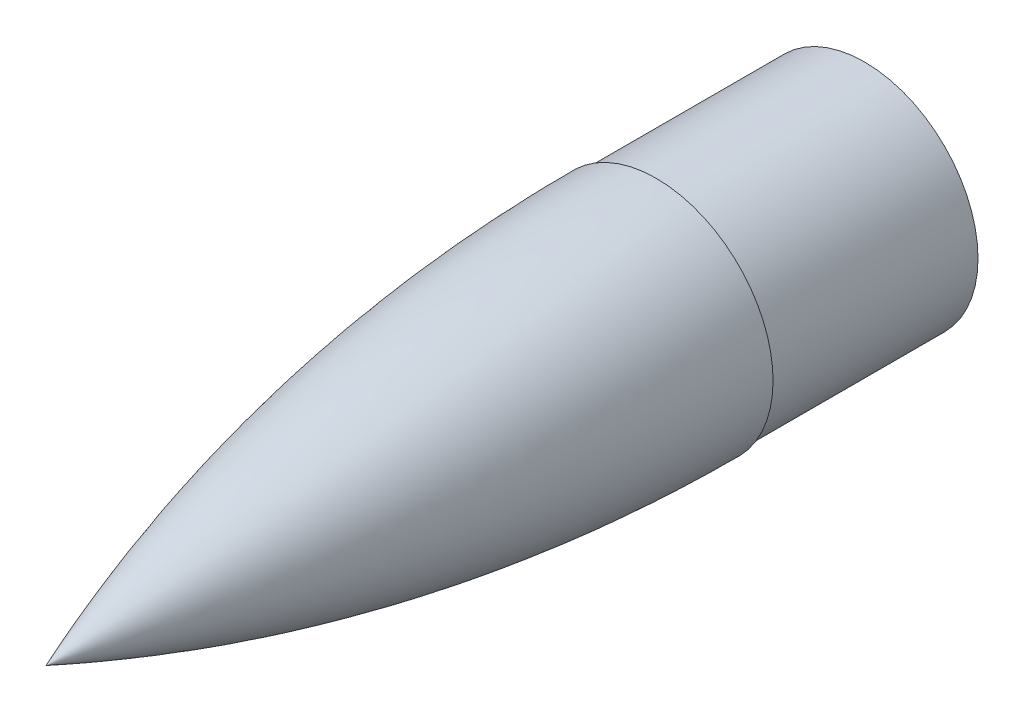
SolidWorks part; units mm, degrees
ref_plane "Front Plane" through (0, 0, 0) normal (0, 0, 1) x (1, 0, 0)
ref_plane "Top Plane" through (0, 0, 0) normal (0, 1, 0) x (1, 0, 0)
ref_plane "Right Plane" through (0, 0, 0) normal (1, 0, 0) x (0, 0, -1)
sketch "Nose cone profile" plane through (0, 0, 0) normal (1, 0, 0) x (0, 0, -1)
  line L7 (0, 0) -> (410, 0)
  line L9 (410, 0) -> (410, 78.5)
  line L10 (0, 0) -> (-160.6939, 0)
  spline S0 degree 4 number of poles 69 (-38.7225, -16.2469) -> (451, 77.7425) construction
  spline S1 degree 4 poles (0, 0) (0.4849, 0.1927) (1.4638, 0.5809) (3.6339, 1.4389) (5.7691, 2.2755) (8.1553, 3.2059) (10.4693, 4.1015) (12.8082, 5.0009) (15.1412, 5.8919) (17.4792, 6.7789) (19.8181, 7.6601) (22.1593, 8.5362) (24.5024, 9.407) (27.4337, 10.4889) (30.9552, 11.7766) (40.9464, 15.3877) (57.4734, 21.1376) (87.1829, 30.8279) (135.2535, 44.6123) (193.7296, 58.194) (250.4833, 67.653) (296.4408, 72.9196) (323.8448, 75.1877) (335.0655, 75.9808) (342.5497, 76.4534) (347.5406, 76.7459) (352.5326, 77.016) (357.5259, 77.2636) (362.5202, 77.4887) (367.5155, 77.6913) (372.5116, 77.8714) (377.5086, 78.029) (382.506, 78.1641) (387.5045, 78.2767) (391.8776, 78.3555) (395.6278, 78.409) (398.4384, 78.4407) (400.3126, 78.4582) (401.8815, 78.4706) (403.1311, 78.479) (404.6758, 78.4878) (406.4598, 78.4955) (408.4318, 78.4991) (409.4782, 78.5) (410, 78.5) knots 0.083497 0.083497 0.083497 0.083497 0.083497 0.088467 0.093437 0.098407 0.103377 0.108347 0.113317 0.118287 0.123257 0.128227 0.133197 0.138167 0.143137 0.153077 0.163017 0.222658 0.282298 0.401579 0.56062 0.699781 0.739541 0.769362 0.779302 0.789242 0.799182 0.809122 0.819062 0.829002 0.838942 0.848882 0.858822 0.868762 0.878702 0.888642 0.893613 0.898583 0.901068 0.903553 0.906038 0.908523 0.913493 0.918463 0.918463 0.918463 0.918463 0.918463
revolve "Nose cone revolve" add sketch "Nose cone profile" angle 360 about L7
sketch "Shoulder profile" plane through (0, 0, -410) normal (0, 0, -1) x (-1, 0, 0)
  circle A0 centre (0, 0) radius 76.2
extrude "Shoulder  extrusion" add sketch "Shoulder profile" along normal blind 140
shell "Shell1" thickness 3.18
sketch "Internal shoulder extension profile" plane through (0, 0, -406.82) normal (0, 0, 1) x (1, 0, 0)
  circle A0 centre (0, 0) radius 73.02 construction
  circle A1 centre (0, 0) radius 73.02
  circle A3 centre (0, 0) radius 75.3153
  circle A4 centre (0, 0) radius 75.3153
  dimension "D1" = 0
extrude "Internal shoulder extrusion" add sketch "Internal shoulder extension profile" along normal up to surface (68.1352 mm away) contours M4 M3
equation "\"Base Diameter\"= 15.7'Base of nose cone"
equation "\"Rad\"= \"Base Diameter\" / 2'DO NOT CHANGE"
equation "\"Length\"= 41'Of nose cone, without shoulder"
equation "\"Shoulder Length\"= 14'Length of shoulder alone"
equation "\"Inner Diameter\"= 6in'Of the body tube the shoulder sits in"
equation "\"WallThick\"= .318'Wall thickness"
equation "\"Rho\"= ( ( \"Rad\" ^ 2 ) + ( \"Length\" ^ 2 ) ) / ( 2 * \"Rad\" )'DO NOT CHANGE"
equation "\"D1@Shoulder profile\" = \"Inner Diameter\""
equation "\"D1@Shoulder  extrusion\" = \"Shoulder Length\""
equation "\"D1@Shell1\"=\"WallThick\""
equation "\"D1@Nose cone profile\" = \"Base Diameter\" + \"Length\" / \"Rho\""
